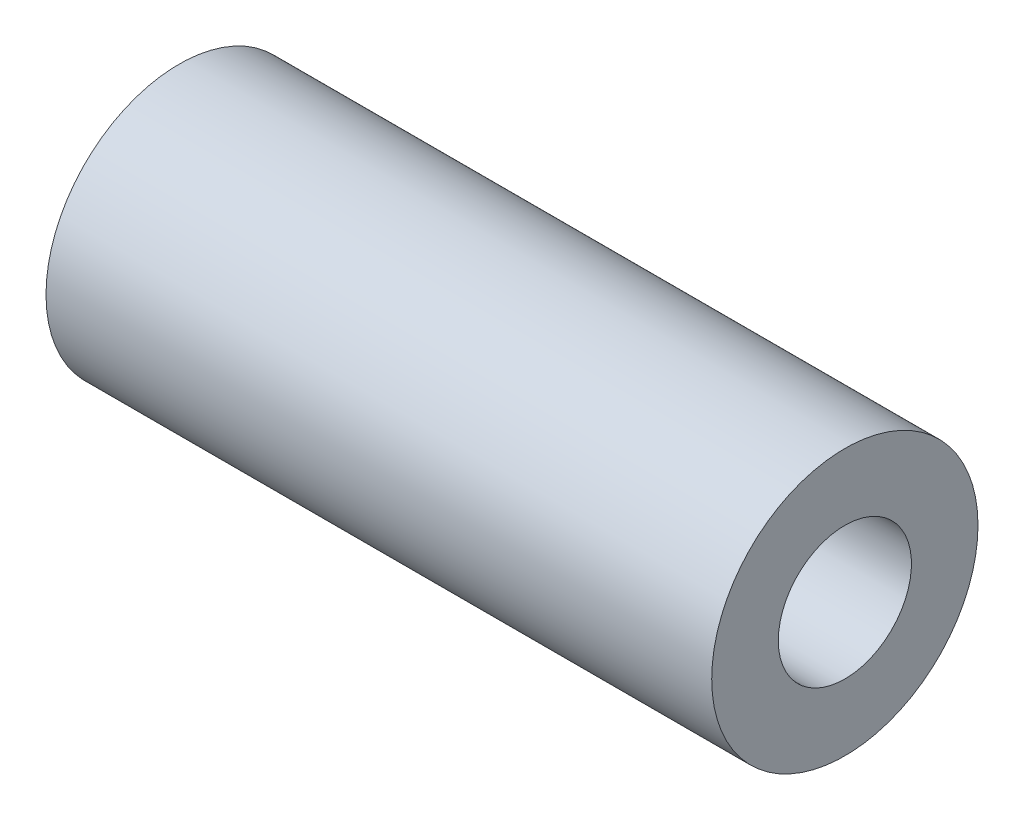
SolidWorks part; units mm, degrees
ref_plane "Vorne" through (0, 0, 0) normal (0, 0, 1) x (1, 0, 0)
ref_plane "Oben" through (0, 0, 0) normal (0, 1, 0) x (1, 0, 0)
ref_plane "Rechts" through (0, 0, 0) normal (1, 0, 0) x (0, 0, -1)
sketch "Skizze1" plane through (0, 0, 0) normal (0, 0, 1) x (1, 0, 0)
  line L0 (0, 9.2704) -> (64.0214, 9.2704) construction
  line L2 (0, 19.2704) -> (50, 19.2704)
  line L3 (0, 19.2704) -> (0, 14.2704)
  line L4 (0, 14.2704) -> (50, 14.2704)
  line L5 (50, 19.2704) -> (50, 14.2704)
  dimension "D1" = 10
  dimension "D2" = 20
  dimension "D3" = 50
revolve "Rotation1" add sketch "Skizze1" angle 360 about L0
